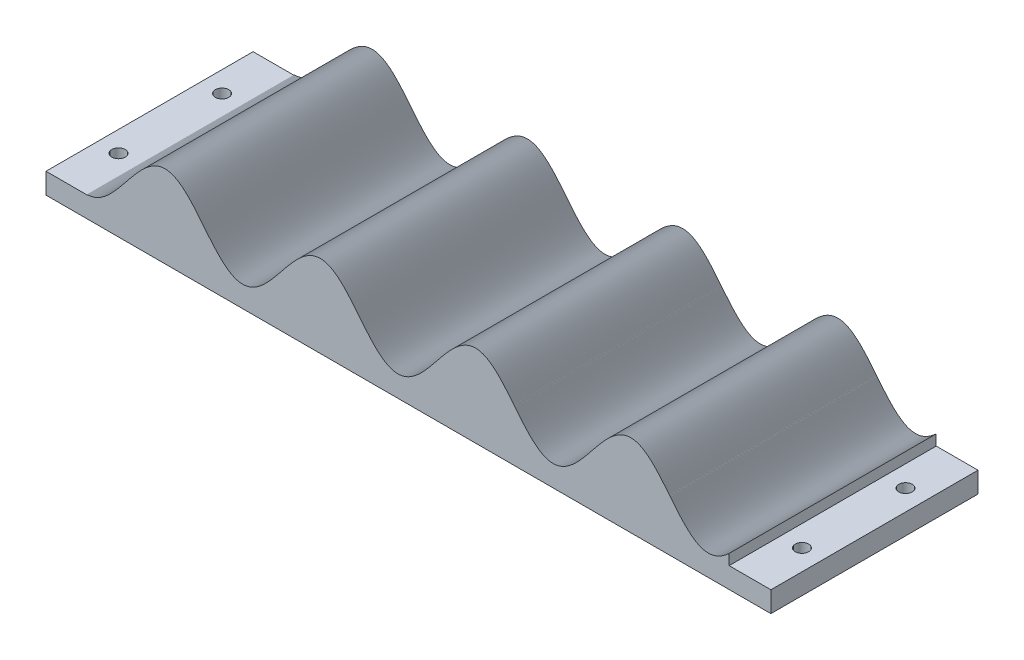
SolidWorks part; units mm, degrees
ref_plane "Front Plane" through (0, 0, 0) normal (0, 0, 1) x (1, 0, 0)
ref_plane "Top Plane" through (0, 0, 0) normal (0, 1, 0) x (1, 0, 0)
ref_plane "Right Plane" through (0, 0, 0) normal (1, 0, 0) x (0, 0, -1)
sketch "Model"
  dimension "D1" = 20
  dimension "D2" = 10
  dimension "D3" = 350
extrude "Boss-Extrude1" add sketch "Model" along normal blind 100
sketch "Sketch2" plane through (0, -10, 0) normal (0, -1, 0) x (1, 0, 0)
  line L0 (155, 100) -> (155, 0) construction
  line L3 (-20, 0) -> (330, 0) construction
  line L5 (-20, 100) -> (-20, 0) construction
  line L6 (-20, 50) -> (330, 50) construction
  line L7 (330, 100) -> (330, 0) construction
  circle A0 centre (-10, 75) radius 3.25
  circle A1 centre (320, 75) radius 3.25
  circle A2 centre (320, 25) radius 3.25
  circle A3 centre (-10, 25) radius 3.25
  point P3 (155, 100)
  dimension "D1" = 6.5
  dimension "D2" = 25
  dimension "D3" = 10
extrude "Cut-Extrude1" cut sketch "Sketch2" against normal through all both and the other way through all
